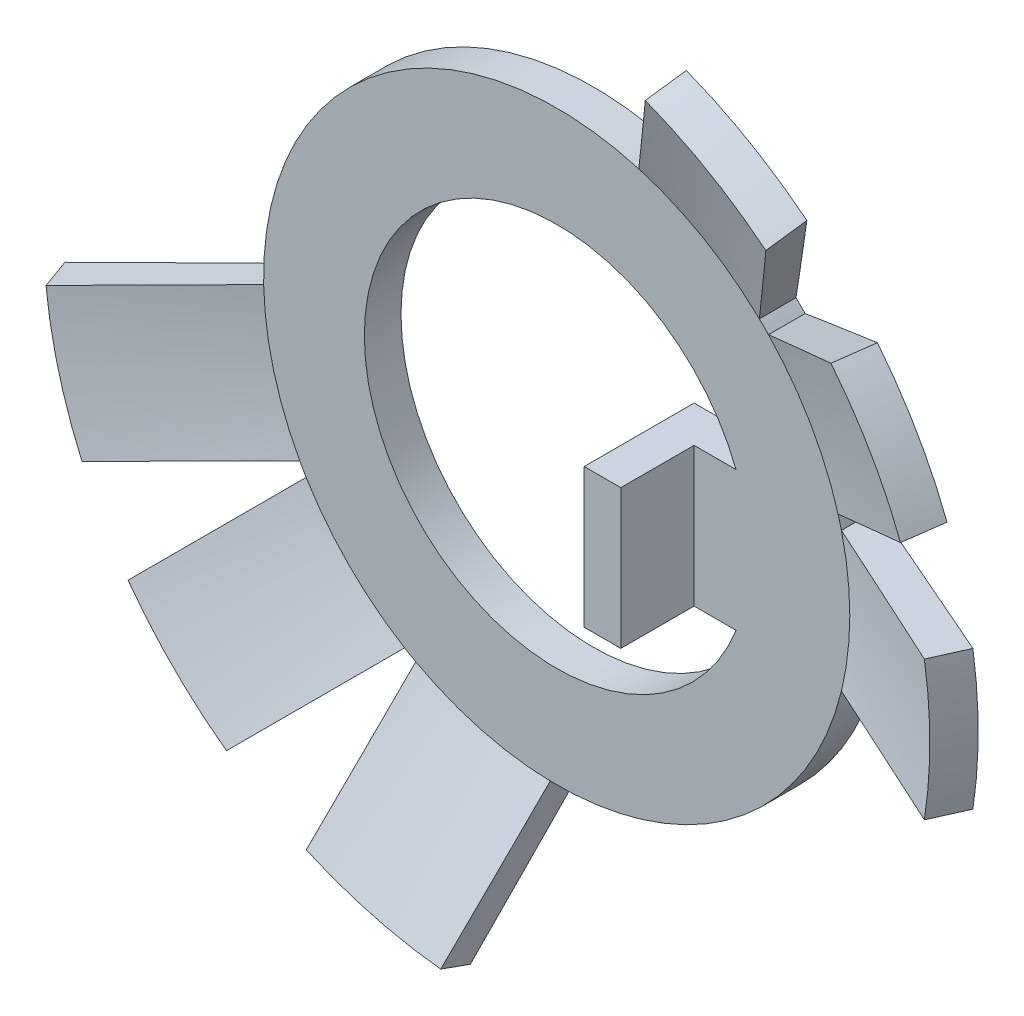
SolidWorks part; units mm, degrees
ref_plane "Front" through (0, 0, 0) normal (0, 0, 1) x (1, 0, 0)
ref_plane "Top" through (0, 0, 0) normal (0, 1, 0) x (1, 0, 0)
ref_plane "Right" through (0, 0, 0) normal (1, 0, 0) x (0, 0, -1)
sketch "Sketch1" plane through (0, 0, 0) normal (1, 0, 0) x (0, 1, 0)
  line L0 (0, -2.9094) -> (-8, -2.9094)
  line L1 (-8, -2.9094) -> (-12.5, -0.9142)
  line L2 (0, 5.8236) -> (0, -8.1378) construction
  line L4 (-12.0947, 0) -> (-8, -1.9094)
  line L5 (-8, -1.9094) -> (0, -1.9094)
  line L6 (0, -1.9094) -> (0, -2.9094)
  line L7 (-12.5, -0.9142) -> (-12.0947, 0)
  dimension "D1" = 16
  dimension "S1" = 1
  dimension "Angle" = 65
  dimension "D" = 25
  dimension "S" = 1
revolve "Base-Extrude" add sketch "Sketch1" angle 360 about L2
sketch "Sketch2" plane through (-2.4044, 1.0036, -2.9094) normal (0, 0, -1) x (-1, 0, 0)
  line L0 (-7.2985, 0.8964) -> (-5.1544, 0.8964)
  line L1 (-5.1544, 0.8964) -> (-5.1544, -2.9036)
  line L2 (-5.1544, -2.9036) -> (-7.2985, -2.9036)
  line L3 (-10.1755, -2.9036) -> (-14.7591, -2.9036)
  line L4 (-10.1755, 0.8964) -> (-14.7591, 0.8964)
  line L5 (-8.1843, 4.5274) -> (-12.1539, 6.8193)
  line L6 (-10.0843, 1.2365) -> (-14.0539, 3.5284)
  line L7 (-4.6445, 6.6764) -> (-6.9363, 10.646)
  line L8 (-7.9354, 4.7764) -> (-10.2272, 8.746)
  line L9 (-2.4044, 13.9688) -> (-2.4044, -17.023) construction
  line L10 (-2.4044, -1.0036) -> (1.5148, -15.6299) construction
  line L11 (-2.2283, -9.0016) -> (-1.042, -13.4291)
  line L12 (1.4422, -8.0181) -> (2.6286, -12.4456)
  line L13 (4.4341, -5.1551) -> (7.6753, -8.3962)
  line L14 (1.7471, -7.8421) -> (4.9883, -11.0832)
  line L15 (5.5937, -1.1796) -> (10.0212, -2.366)
  line L16 (4.6102, -4.8501) -> (9.0377, -6.0365)
  line L17 (-2.4044, -1.0036) -> (-2.2283, -9.0016) construction
  arc A0 (-7.2985, -2.9036) -> (-7.2985, 0.8964) centre (-2.4044, -1.0036) ccw
  circle A1 centre (-2.4044, -1.0036) radius 8 construction
  arc A2 (-10.1755, -2.9036) -> (-2.2283, -9.0016) centre (-2.4044, -1.0036) ccw
  arc A4 (-12.1539, 6.8193) -> (-14.0539, 3.5284) centre (-2.4044, -1.0036) ccw
  arc A5 (-7.9354, 4.7764) -> (-8.1843, 4.5274) centre (-2.4044, -1.0036) ccw
  arc A6 (-10.0843, 1.2365) -> (-10.1755, 0.8964) centre (-2.4044, -1.0036) ccw
  arc A7 (-14.7591, 0.8964) -> (-14.7591, -2.9036) centre (-2.4044, -1.0036) ccw
  arc A8 (-6.9363, 10.646) -> (-10.2272, 8.746) centre (-2.4044, -1.0036) ccw
  arc A9 (-1.042, -13.4291) -> (2.6286, -12.4456) centre (-2.4044, -1.0036) ccw
  arc A10 (4.9883, -11.0832) -> (7.6753, -8.3962) centre (-2.4044, -1.0036) ccw
  arc A11 (9.0377, -6.0365) -> (10.0212, -2.366) centre (-2.4044, -1.0036) ccw
  arc A12 (5.5937, -1.1796) -> (-4.6445, 6.6764) centre (-2.4044, -1.0036) ccw
  arc A13 (4.4341, -5.1551) -> (4.6102, -4.8501) centre (-2.4044, -1.0036) ccw
  arc A14 (1.4422, -8.0181) -> (1.7471, -7.8421) centre (-2.4044, -1.0036) ccw
  circle A16 centre (-2.4044, -1.0036) radius 12.5 construction
  dimension "D2" = 30
  dimension "d" = 10.5
  dimension "b1" = 3.8
  dimension "b2" = 1.9
  dimension "a" = 8
  dimension "D6" = 3.8
  dimension "D7" = 1.9
  dimension "D8" = 30
  dimension "D9" = 15
  dimension "b" = 3.8
  dimension "D11" = 1.9
extrude "Cut-Extrude" cut sketch "Sketch2" against normal through all flip side to cut
sketch "Sketch4" plane through (2.75, -0.6673, -0.255) normal (-1, 0, 0) x (0, 1, 0)
  line L1 (-1.2327, 1.6543) -> (2.5673, 1.6543)
  line L2 (-1.2327, 1.6543) -> (-1.2327, -0.3457)
  line L3 (-1.2327, -0.3457) -> (2.5673, -0.3457)
  line L4 (2.5673, 1.6543) -> (2.5673, -0.3457)
  line L8 (-1.2327, 1.6543) -> (2.5673, 1.6543) construction
  line L9 (2.5673, 1.6543) -> (2.5673, 2.6543) construction
  line L10 (-1.2327, 1.6543) -> (-1.2327, 2.6543) construction
  line L11 (2.5673, 2.6543) -> (-1.2327, 2.6543) construction
  dimension "h" = 3
extrude "Extrude1" add sketch "Sketch4" against normal blind 1
equation "\"D11@Sketch2\" = \"b@Sketch2\" / 2"
equation "\"D6@Sketch2\" = \"b@Sketch2\""
equation "\"D7@Sketch2\" = \"b@Sketch2\" / 2"
equation "\"S1@Sketch1\" = \"S@Sketch1\""
equation "\"b2@Sketch2\" = \"b@Sketch2\" / 2"
equation "\"b1@Sketch2\" = \"b@Sketch2\""
equation "\"D1@Extrude1\"=\"S@Sketch1\""
